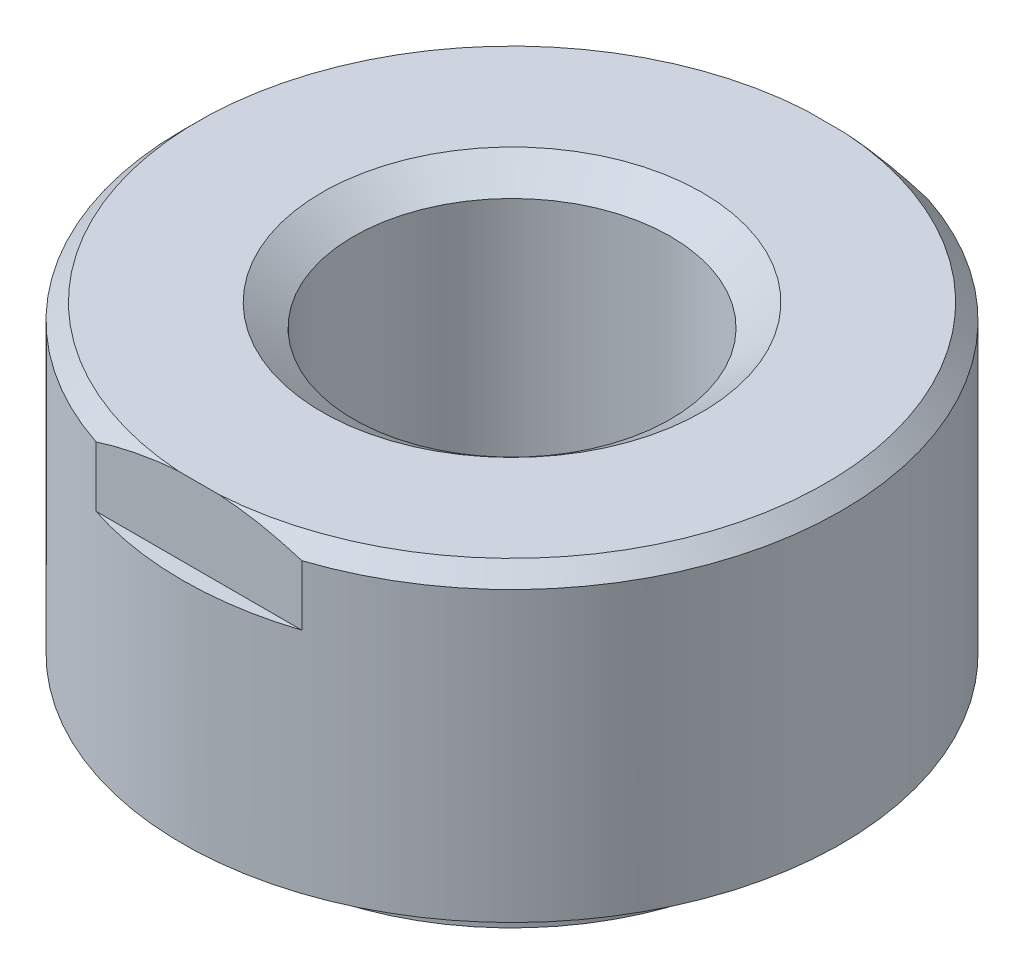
SolidWorks part; units mm, degrees
ref_plane "Plane1" through (0, 0, 0) normal (0, 0, 1) x (1, 0, 0)
ref_plane "Plane2" through (0, 0, 0) normal (0, 1, 0) x (1, 0, 0)
ref_plane "Plane3" through (0, 0, 0) normal (1, 0, 0) x (0, 0, -1)
sketch "BodySke" plane through (0, 0, 0) normal (0, 0, 1) x (1, 0, 0)
  line L0 (5.9003, 0) -> (6.3373, 0)
  line L1 (8.255, 0) -> (8.255, 7.62)
  line L2 (8.255, 7.62) -> (3.9688, 7.62)
  line L3 (3.9688, 7.62) -> (3.9688, -1.4732)
  line L4 (3.9688, -1.4732) -> (6.3373, -1.4732)
  line L5 (6.3373, -1.4732) -> (6.3373, -1.3462)
  line L6 (6.3373, -1.3462) -> (5.9003, -0.5893)
  line L7 (1.016, 1.5875) -> (3.6522, 1.5875) construction
  line L8 (6.3373, -0.5893) -> (7.2961, -0.5893)
  line L9 (0, 0) -> (0, 15.24) construction
  line L10 (5.9003, -0.5893) -> (5.9003, 0)
  line L11 (7.2961, -0.5893) -> (7.2961, 0)
  line L12 (6.3373, -0.5893) -> (6.3373, 0)
  line L13 (7.2961, 0) -> (8.255, 0)
  dimension "D1" = 60
  dimension "E_dia" = 16.51
  dimension "C_dia" = 12.6746
  dimension "A_ht" = 1.4732
  dimension "T_ht" = 7.62
  dimension "Thread_min" = 7.9375
  dimension "C_len" = 0.127
  dimension "Clinching_ht" = 0.5893
  dimension "Advance" = 1.5875
  dimension "Clinching_dia" = 14.5923
revolve "Body" add sketch "BodySke"
revolve "EndChamfer" cut sketch "EndChamferSke" angle 360 about L0
sketch "EndChamferSke" plane through (0, 0, 0) normal (0, 0, 1) x (1, 0, 0)
  line L0 (0, -2.54) -> (0, 7.62) construction
  line L1 (0, 0) -> (0, 15.24) construction
  line L2 (4.7625, -1.7272) -> (4.7625, -1.4707)
  line L3 (4.7625, -1.4707) -> (3.9688, -0.9151)
  line L4 (3.9688, -0.9151) -> (3.9688, -1.7272)
  line L5 (3.9688, -1.7272) -> (4.7625, -1.7272)
  line L6 (4.7625, 7.62) -> (3.9688, 7.0644)
  line L8 (3.9688, 7.0644) -> (3.9688, 7.62)
  line L9 (4.7625, 7.62) -> (3.9688, 7.62)
  line L10 (3.9688, 7.62) -> (-3.9688, 7.62) construction
  line L11 (-6.3373, -1.4732) -> (6.3373, -1.4732) construction
  dimension "D1" = 0.254
  dimension "Thread_nominal" = 9.525
  dimension "D2" = 34.99
  dimension "Thread_min" = 7.9375
  dimension "Inset" = 0.0025
chamfer "Chamfer" distance 0.3969 1 edges at (0, 7.62, -8.255)
sketch "FlatsSke" plane through (0, 7.62, 0) normal (0, 1, 0) x (-1, 0, 0)
  line L0 (-8.255, 7.8423) -> (8.255, 7.8423)
  line L1 (8.255, 7.8423) -> (8.255, 8.6678)
  line L2 (8.255, 8.6678) -> (-8.255, 8.6678)
  line L3 (-8.255, 8.6678) -> (-8.255, 7.8423)
  line L4 (-8.255, -7.8423) -> (8.255, -7.8422)
  line L5 (8.255, -7.8422) -> (8.255, -8.6678)
  line L6 (8.255, -8.6678) -> (-8.255, -8.6678)
  line L7 (-8.255, -8.6678) -> (-8.255, -7.8423)
  line L8 (0, 9.144) -> (0, -9.144) construction
  line L9 (-9.144, 0) -> (9.144, 0) construction
  dimension "D1" = 16.51
  dimension "D2" = 15.6845
  dimension "D3" = 17.3355
extrude "Flats" cut sketch "FlatsSke" against normal blind 1.905
ref_plane "Plane4" through (0, -0.5486, 0) normal (0, 1, 0) x (-1, 0, 0)
sketch "ThdSchSke" plane through (0, 0, 0) normal (0, 0, 1) x (1, 0, 0)
  line L0 (0, -5.08) -> (0, 7.62) construction
  line L1 (0, 0) -> (0, 15.24) construction
  line L2 (0, -1.4707) -> (4.7625, -1.4707) construction
  line L4 (4.7625, -1.4707) -> (3.9688, -0.9149)
  line L6 (4.7625, -1.4707) -> (3.9688, -2.0264)
  line L7 (3.9688, -0.9149) -> (3.9688, -2.0264)
  line L8 (4.7625, -1.4707) -> (-4.7625, -1.4707) construction
  dimension "Vee_angle" = 70
  dimension "Thread_nominal" = 9.525
  dimension "Thread_min" = 7.9375
revolve "ThreadSchematic" [suppressed] cut sketch "ThdSchSke" angle 360 about L0
pattern_linear "ThdSchPat" [suppressed]
sketch "CliCutSke" plane through (0, -0.5893, 0) normal (0, -1, 0) x (1, 0, 0)
  line L0 (0, 0) -> (0, 8.382) construction
  line L1 (0, 0) -> (0.9523, 7.2337) construction
  circle A0 centre (0.9523, 7.2337) radius 0.8255
  circle A1 centre (0, 0) radius 7.2961 construction
  dimension "Cut_dia" = 1.651
  dimension "Half_angle" = 7.5
extrude "ClinchingCut" cut sketch "CliCutSke" against normal blind 0.5893
pattern_circular "ClinchingCutPat" count 24 every 15 about axis through (0, 0, 0) along (0, 1, 0) of "ClinchingCut"
equation "' \"A_ht@BodySke\" = 0.058"
equation "' \"C_dia@BodySke\" = 0.499"
equation "' \"E_dia@BodySke\" = 0.65"
equation "' \"T_ht@BodySke\" = 0.3"
equation "' \"Advance@BodySke\" = 0.0625"
equation "' \"Thread_min@BodySke\" = 0.3125"
equation "' \"Thread_nominal@ThreadCosmetic\" = 0.375"
equation "\"Count@ClinchingCutPat\" = 24"
equation "\"Angle@ClinchingCutPat\" = 360 / \"Count@ClinchingCutPat\""
equation "\"Half_angle@CliCutSke\" = 180 / \"Count@ClinchingCutPat\""
equation "\"Cut_dia@CliCutSke\" = \"E_dia@BodySke\" * 0.1"
equation "\"Clinching_dia@BodySke\" = ( \"E_dia@BodySke\" + \"C_dia@BodySke\" ) /2"
equation "\"Clinching_ht@BodySke\" = \"A_ht@BodySke\" * 0.4"
equation "\"Clinching_ht@ClinchingCut\" =  \"A_ht@BodySke\" * 0.4"
equation "\"D1@FlatsSke\" = \"E_dia@BodySke\""
equation "\"D2@FlatsSke\" = \"E_dia@BodySke\" * 0.95"
equation "\"D3@FlatsSke\" = \"E_dia@BodySke\" * 1.05"
equation "\"Depth@Flats\" = \"T_ht@BodySke\" * 0.25"
equation "\"Width@Chamfer\" = ( \"Thread_nominal@ThreadCosmetic\" - \"Thread_min@BodySke\" ) / 4"
equation "\"Thread_nominal@EndChamferSke\" = \"Thread_nominal@ThreadCosmetic\""
equation "\"Thread_min@EndChamferSke\" = \"Thread_min@BodySke\""
equation "\"D2@EndChamferSke\" = \"Vee_angle@ThdSchSke\" / 2 - 0.01"
equation "\"Thread_nominal@ThdSchSke\" = \"Thread_nominal@ThreadCosmetic\""
equation "\"Thread_min@ThdSchSke\" = \"Thread_min@BodySke\""
equation "\"Num_threads@ThdSchPat\" = int(  ( \"A_ht@BodySke\" + \"T_ht@BodySke\" - \"Inset@EndChamferSke\" ) / \"Advance@BodySke\" + 0.999 )  + 1"
equation "\"Advance@ThdSchPat\" = (  \"A_ht@BodySke\" + \"T_ht@BodySke\" - \"Inset@EndChamferSke\"  ) /  (\"Num_threads@ThdSchPat\" - 1) 'relax it"
